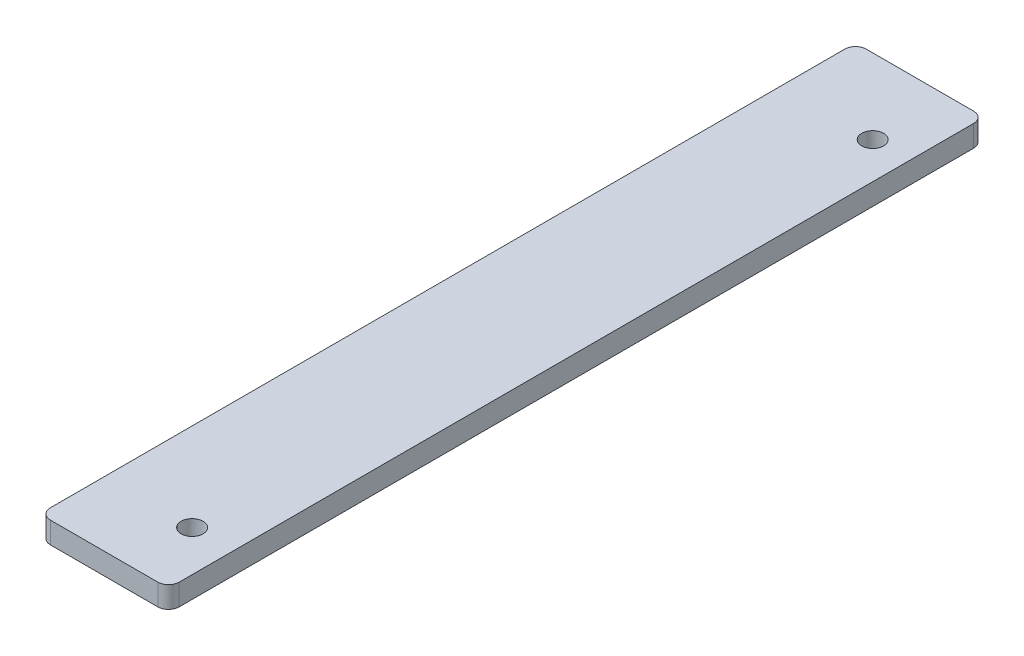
SolidWorks part; units mm, degrees
ref_plane "Plan de face" through (0, 0, 0) normal (0, 0, 1) x (1, 0, 0)
ref_plane "Plan de dessus" through (0, 0, 0) normal (0, 1, 0) x (1, 0, 0)
ref_plane "Plan de droite" through (0, 0, 0) normal (1, 0, 0) x (0, 0, -1)
ref_plane "Plan1" through (0, 5, 0) normal (0, 1, 0) x (1, 0, 0)
sketch "Esquisse1" plane through (0, 5, 0) normal (0, 1, 0) x (1, 0, 0)
  line L0 (-25, -190) -> (25, -190)
  line L1 (30, -185) -> (30, 185)
  line L2 (25, 190) -> (-25, 190)
  line L3 (-30, 185) -> (-30, -185)
  circle A0 centre (13, 155) radius 5.1
  circle A1 centre (11, -160) radius 5.1
  arc A2 (-30, -185) -> (-25, -190) centre (-25, -185) ccw
  arc A3 (25, -190) -> (30, -185) centre (25, -185) ccw
  arc A4 (30, 185) -> (25, 190) centre (25, 185) ccw
  arc A5 (-25, 190) -> (-30, 185) centre (-25, 185) ccw
extrude "Boss.-Extru.1" add sketch "Esquisse1" against normal blind 10
